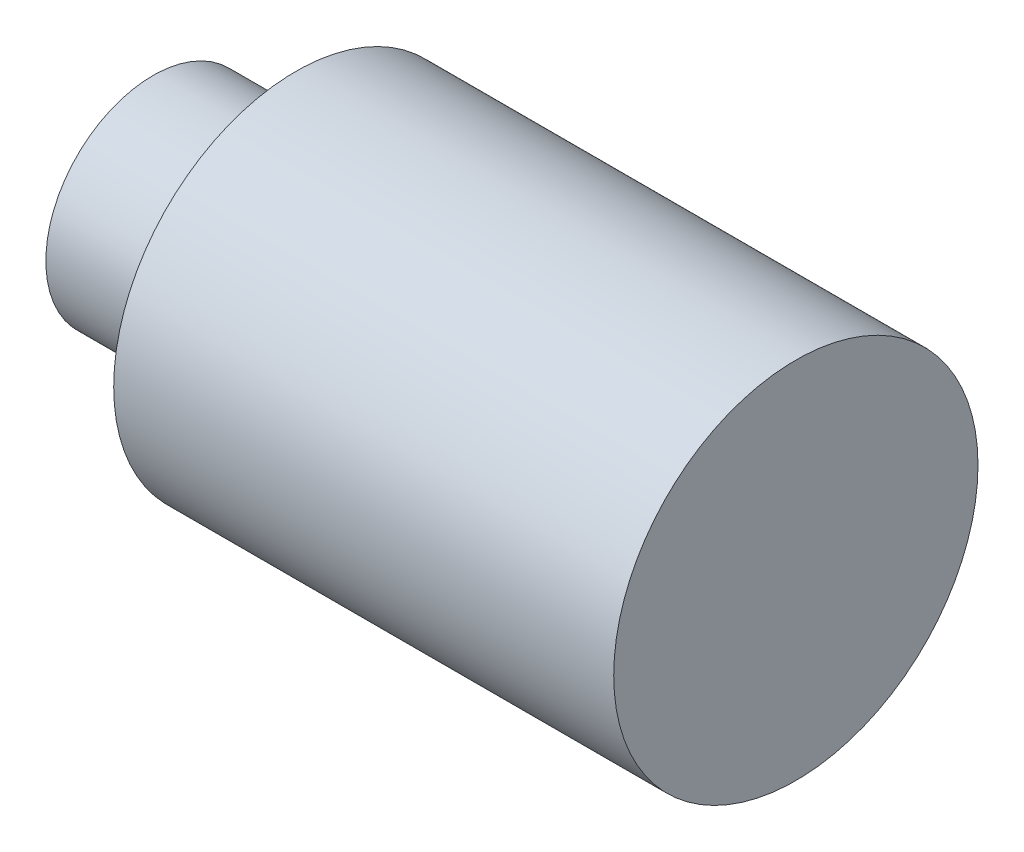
SolidWorks part; units mm, degrees
ref_plane "前视基准面" through (0, 0, 0) normal (0, 0, 1) x (1, 0, 0)
ref_plane "上视基准面" through (0, 0, 0) normal (0, 1, 0) x (1, 0, 0)
ref_plane "右视基准面" through (0, 0, 0) normal (1, 0, 0) x (0, 0, -1)
sketch "草图1" plane through (0, 0, 0) normal (1, 0, 0) x (0, 0, -1)
  circle A0 centre (0, 0) radius 1.5
  dimension "D1" = 3
extrude "凸台-拉伸1" add sketch "草图1" along normal blind 2
sketch "草图2" plane through (2, 0, 0) normal (1, 0, 0) x (0, 0, -1)
  circle A0 centre (0, 0) radius 2.55
  dimension "D1" = 5.1
extrude "凸台-拉伸2" add sketch "草图2" along normal blind 7
